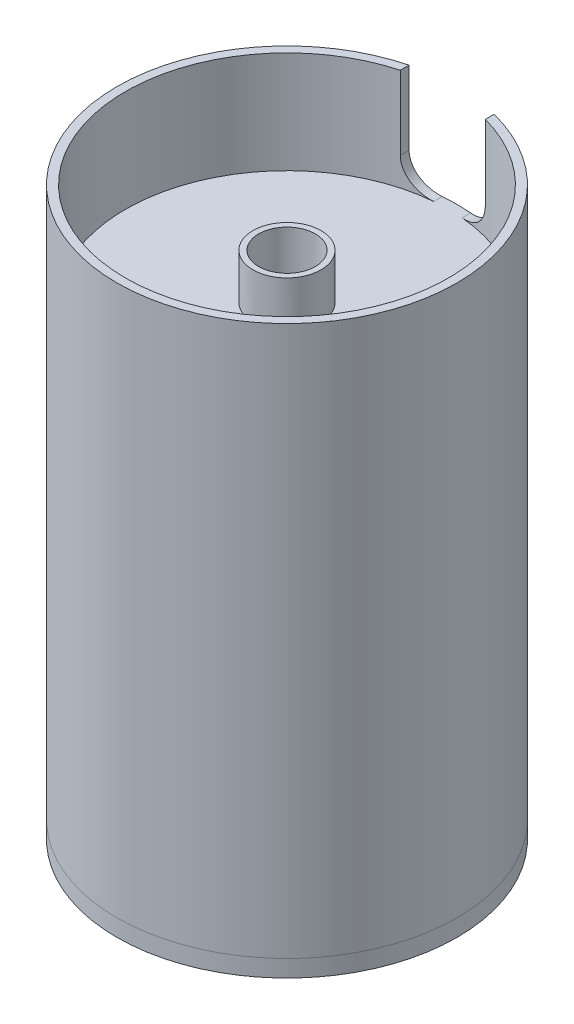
SolidWorks part; units mm, degrees
ref_plane "Alzado" through (0, 0, 0) normal (0, 0, 1) x (1, 0, 0)
ref_plane "Planta" through (0, 0, 0) normal (0, 1, 0) x (1, 0, 0)
ref_plane "Vista lateral" through (0, 0, 0) normal (1, 0, 0) x (0, 0, -1)
sketch "Croquis1" plane through (0, 0, 0) normal (0, 1, 0) x (1, 0, 0)
  circle A0 centre (0, 0) radius 30
  dimension "D1" = 60
extrude "Saliente-Extruir1" add sketch "Croquis1" against normal blind 97
shell "Vaciado1" thickness 1.5
sketch "Croquis2" plane through (0, 0, 0) normal (0, 0, 1) x (1, 0, 0)
  line L0 (-30, -97) -> (30, -97) construction
  line L1 (-26, -100) -> (-30, -100)
  line L3 (-28.5353, -97) -> (-30, -97)
  line L4 (-30, -100) -> (-30, -97)
  line L7 (-26, -100) -> (-20, -94)
  line L8 (-20, -94) -> (-28.5353, -94)
  line L9 (-28.5353, -94) -> (-28.5353, -97)
  line L10 (-28.5353, -97) -> (-30, -97)
  line L11 (0, -89.1405) -> (0, -95.6162) construction
  point P0 (0, -98.3106)
  dimension "D1" = 4
  dimension "D2" = 10
  dimension "D3" = 6
  dimension "D4" = 3
revolve "Revolución1" add sketch "Croquis2" angle 360 about L11
sketch "Croquis3" plane through (0, -94, 0) normal (0, 1, 0) x (1, 0, 0)
  circle A0 centre (0, 0) radius 25
  circle A1 centre (0, 0) radius 18
  dimension "D1" = 50
  dimension "D2" = 36
extrude "Saliente-Extruir2" add sketch "Croquis3" along normal blind 3 separate body
sketch "Croquis4" plane through (0, -94, 0) normal (0, -1, 0) x (1, 0, 0)
  circle A0 centre (0, 0) radius 18
extrude "Saliente-Extruir3" add sketch "Croquis4" against normal blind 1 separate body
ref_plane "Plano1" through (0, 0, -50) normal (0, 0, 1) x (1, 0, 0)
sketch "Croquis6" plane through (0, 0, 0) normal (0, 0, 1) x (1, 0, 0)
  line L0 (30, 0) -> (-30, 0) construction
  line L1 (-2.5, -18) -> (2.5, -18)
  line L2 (-7.5, -13) -> (-7.5, 34.7334)
  line L3 (-7.5, 34.7334) -> (7.5, 34.7334)
  line L4 (7.5, -13) -> (7.5, 34.7334)
  line L5 (-7.5, -18) -> (7.5, 34.7334) construction
  line L6 (-7.5, 34.7334) -> (7.5, -18) construction
  arc A0 (2.5, -18) -> (7.5, -13) centre (2.5, -13) ccw
  arc A1 (-2.5, -18) -> (-7.5, -13) centre (-2.5, -13) cw
  point P0 (0, 8.3667)
  dimension "D3" = 5
  dimension "D1" = 18
  dimension "D2" = 15
extrude "Cortar-Extruir1" cut sketch "Croquis6" against normal blind 40
ref_plane "Plano2" through (0, -18, 0) normal (0, 1, 0) x (1, 0, 0)
sketch "Croquis9" plane through (0, -18, 0) normal (0, 1, 0) x (1, 0, 0)
  circle A0 centre (0, 0) radius 28.5
extrude "Cortar-Extruir2" cut sketch "Croquis9" along normal blind 48
sketch "Croquis7" plane through (0, -18, 0) normal (0, 1, 0) x (1, 0, 0)
  circle A0 centre (0, 0) radius 28.5
extrude "Saliente-Extruir5" add sketch "Croquis7" against normal blind 3
sketch "Croquis8" plane through (0, -18, 0) normal (0, 1, 0) x (1, 0, 0)
  circle A0 centre (0, 0) radius 6
  circle A1 centre (0, 0) radius 5
  dimension "D1" = 12
  dimension "D2" = 10
extrude "Saliente-Extruir6" add sketch "Croquis8" along normal blind 8
